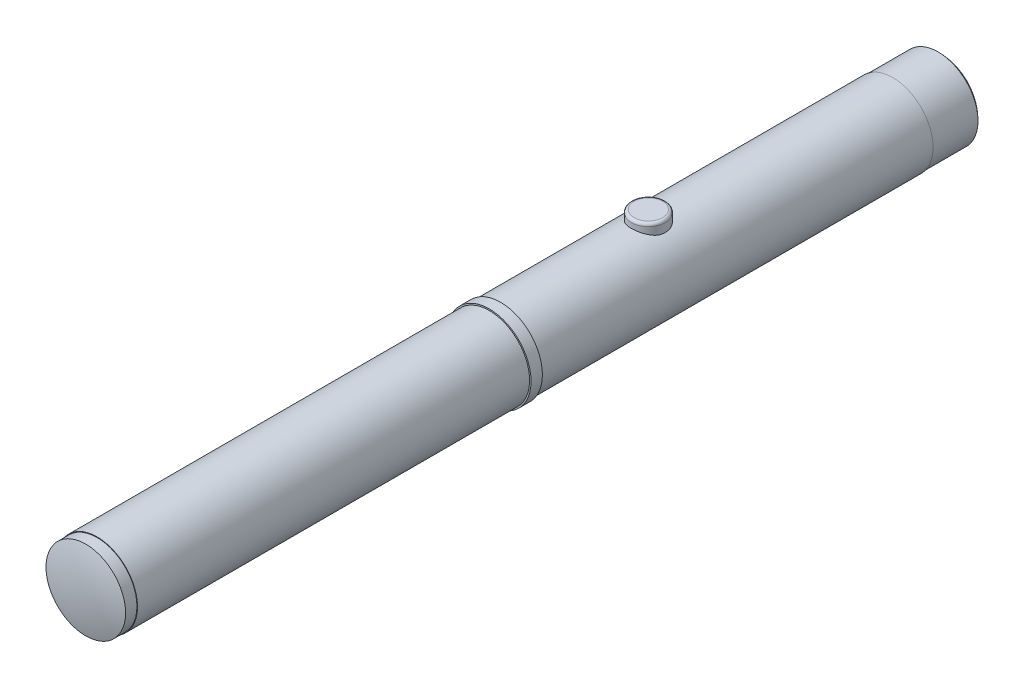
SolidWorks part; units mm, degrees
ref_plane "Alzado" through (0, 0, 0) normal (0, 0, 1) x (1, 0, 0)
ref_plane "Planta" through (0, 0, 0) normal (0, 1, 0) x (1, 0, 0)
ref_plane "Vista lateral" through (0, 0, 0) normal (1, 0, 0) x (0, 0, -1)
sketch "Croquis2" plane through (0, 0, 0) normal (0, 0, 1) x (1, 0, 0)
  circle A0 centre (0, 0) radius 7.1
  dimension "D1" = 14.2
extrude "Saliente-Extruir1" add sketch "Croquis2" along normal blind 140
sketch "Croquis4" plane through (0, 0, 0) normal (0, 1, 0) x (1, 0, 0)
  line L0 (-7, -142) -> (-7, -140)
  line L1 (-7.1, -140) -> (7.1, -140) construction
  line L2 (-7, -140) -> (0, -140)
  line L3 (0, -140) -> (0, -143) construction
  line L4 (0, -143) -> (-7, -143) construction
  line L5 (-2.25, 0) -> (-2.25, 10)
  line L6 (7.1, 0) -> (-7.1, 0) construction
  line L7 (-2.25, 0) -> (-7, 0)
  line L8 (-7, 0) -> (-7, 8)
  line L9 (-2.25, 10) -> (-7, 10) construction
  line L10 (-7, 10) -> (-7, 8) construction
  line L11 (0, 0) -> (0, 10) construction
  line L12 (0, -140) -> (0, -143)
  line L13 (-7.1, 0) -> (-7.1, -140) construction
  line L14 (-7.35, -69) -> (-6.85, -69)
  line L15 (-7.35, -69) -> (-7.35, -71)
  line L16 (-7.35, -71) -> (-6.85, -71)
  line L17 (-6.85, -69) -> (-6.85, -71)
  line L18 (-7.35, -69) -> (-6.85, -71) construction
  line L19 (-7.35, -71) -> (-6.85, -69) construction
  arc A0 (0, -143) -> (-7, -142) centre (0, -118) cw
  arc A1 (-2.25, 10) -> (-7, 8) centre (-2.25, 3.3594) ccw
  point P18 (-7.1, -70)
  dimension "D1" = 2
  dimension "D2" = 14
  dimension "D3" = 3
  dimension "D4" = 14
  dimension "D5" = 4.5
  dimension "D6" = 8
  dimension "D7" = 10
  dimension "D8" = 2
  dimension "D9" = 0.5
revolve "Revolución1" add sketch "Croquis4" angle 360 about L11
ref_plane "Plano1" through (0, 6.5, 0) normal (0, 1, 0) x (1, 0, 0)
sketch "Croquis5" plane through (0, 6.5, 0) normal (0, 1, 0) x (1, 0, 0)
  line L0 (7.1, 0) -> (-7.1, 0) construction
  circle A0 centre (0, -43) radius 3
  dimension "D1" = 6
  dimension "D2" = 43
extrude "Saliente-Extruir2" add sketch "Croquis5" along normal blind 2
fillet "Redondeo1" radius 0.5 1 edges at (0, 8.5, 46)
